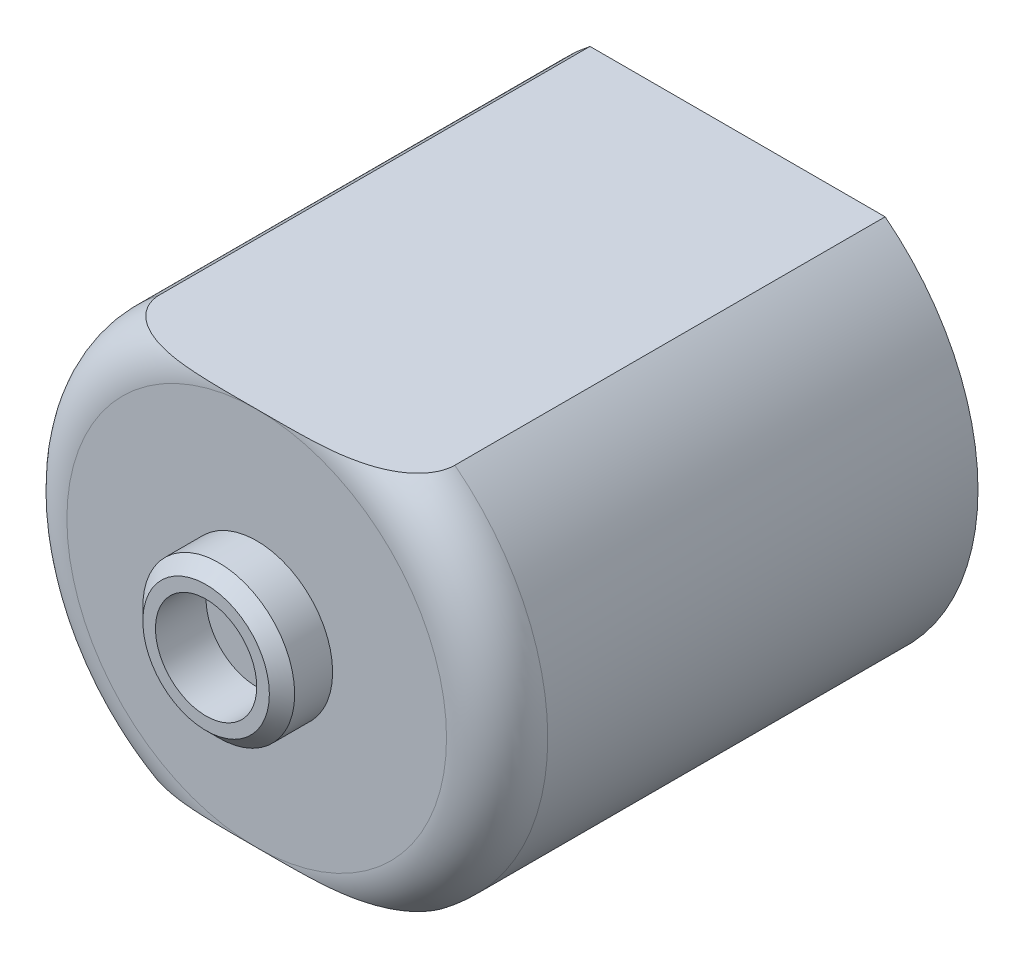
SolidWorks part; units mm, degrees
ref_plane "Face" through (0, 0, 0) normal (0, 0, 1) x (1, 0, 0)
ref_plane "Dessus" through (0, 0, 0) normal (0, 1, 0) x (1, 0, 0)
ref_plane "Droite" through (0, 0, 0) normal (1, 0, 0) x (0, 0, -1)
sketch "Esquisse1" plane through (0, 0, 0) normal (0, 0, 1) x (1, 0, 0)
  circle A0 centre (0, 0) radius 9.5
  dimension "D1" = 19
extrude "Extrusion1" add sketch "Esquisse1" along normal blind 19
fillet "Congé1" radius 2 1 edges at (9.5, 0, 19)
sketch "Esquisse2" plane through (0, 0, 19) normal (0, 0, 1) x (1, 0, 0)
  line L0 (-11.1773, 0) -> (12.5313, 0) construction
  line L1 (-9.5, 7.5) -> (9.5, 7.5)
  line L2 (-9.5, 7.5) -> (-9.5, -7.5)
  line L3 (-9.5, -7.5) -> (9.5, -7.5)
  line L4 (9.5, 7.5) -> (9.5, -7.5)
  circle A0 centre (0, 0) radius 9.5 construction
  dimension "D1" = 15
extrude "Enlèv. mat.-Extru.1" cut sketch "Esquisse2" against normal through all flip side to cut
sketch "Esquisse3" plane through (0, 0, 19) normal (0, 0, 1) x (1, 0, 0)
  circle A0 centre (0, 0) radius 2
  circle A1 centre (0, 0) radius 3
  dimension "D1" = 4
  dimension "D2" = 6
extrude "Extrusion2" add sketch "Esquisse3" along normal blind 2
chamfer "Chanfrein1" distance 0.5 angle 45 1 edges at (3, 0, 21)
